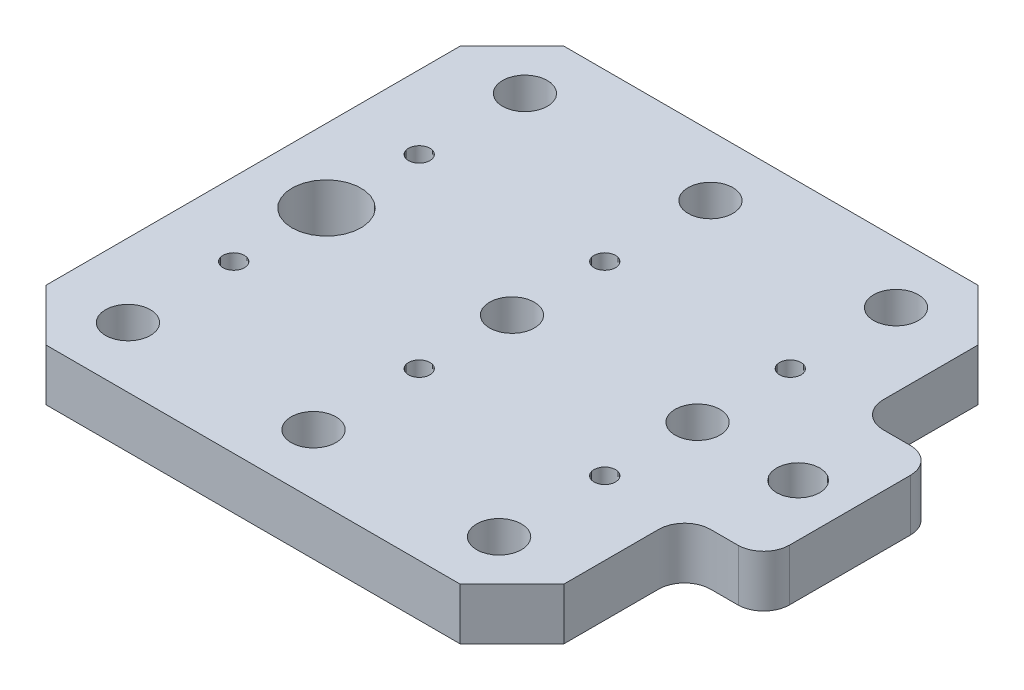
SolidWorks part; units mm, degrees
ref_plane "Alzado" through (0, 0, 0) normal (0, 0, 1) x (1, 0, 0)
ref_plane "Planta" through (0, 0, 0) normal (0, 1, 0) x (1, 0, 0)
ref_plane "Vista lateral" through (0, 0, 0) normal (1, 0, 0) x (0, 0, -1)
other "Graphic1"
other "Graphic (Closed) -1"
imported_body "Imported1"
other "Convert Mesh to Standard1"
sketch "Sketch2" plane through (0, 6, 0) normal (0, 1, 0) x (1, 0, 0)
  line L0 (19.1627, 5.0734) -> (19.1627, -18.9029)
  line L5 (19.1627, -18.9029) -> (39.9178, -18.9029)
  line L6 (39.9178, -18.9029) -> (39.9178, 11.1207)
  line L7 (39.9178, 11.1207) -> (19.1627, 11.1207)
  line L8 (19.1627, 11.1207) -> (19.1627, 5.0734)
  circle A0 centre (-41.5, -5) radius 4
  point P2 (-41.5, -5)
  dimension "D1" = 8
extrude "Cut-Extrude1" cut sketch "Sketch2" against normal blind 10
sketch "Sketch3" plane through (0, 6, 0) normal (0, 1, 0) x (1, 0, 0)
  line L0 (19.1627, 5) -> (19.1627, -15) construction
  circle A0 centre (13.1627, -5) radius 2.5
  point P5 (19.1627, -5)
  dimension "D1" = 5
  dimension "D2" = 6
extrude "Cut-Extrude2" cut sketch "Sketch3" against normal blind 10 contours A0
fillet "Fillet1" radius 3
